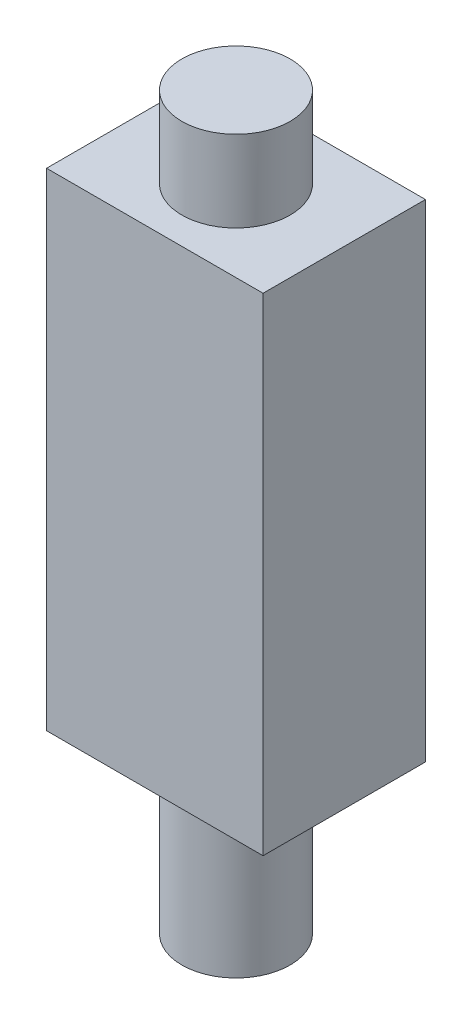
SolidWorks part; units mm, degrees
ref_plane "Front Plane" through (0, 0, 0) normal (0, 0, 1) x (1, 0, 0)
ref_plane "Top Plane" through (0, 0, 0) normal (0, 1, 0) x (1, 0, 0)
ref_plane "Right Plane" through (0, 0, 0) normal (1, 0, 0) x (0, 0, -1)
sketch "Sketch1" plane through (0, 0, 0) normal (0, 1, 0) x (1, 0, 0)
  circle A0 centre (0, 0) radius 1
  dimension "D1" = 2
extrude "Boss-Extrude1" add sketch "Sketch1" along normal blind 3
sketch "Sketch2" plane through (0, 3, 0) normal (0, 1, 0) x (1, 0, 0)
  line L1 (-2, -1.5) -> (2, -1.5)
  line L2 (-2, -1.5) -> (-2, 1.5)
  line L3 (-2, 1.5) -> (2, 1.5)
  line L4 (2, -1.5) -> (2, 1.5)
  line L5 (-2, -1.5) -> (2, 1.5) construction
  line L6 (-2, 1.5) -> (2, -1.5) construction
  point P0 (0, 0)
  dimension "D1" = 4
  dimension "D2" = 3
extrude "Boss-Extrude2" add sketch "Sketch2" along normal blind 9
sketch "Sketch3" plane through (0, 12, 0) normal (0, 1, 0) x (1, 0, 0)
  circle A0 centre (0, 0) radius 1
  dimension "D1" = 2
extrude "Boss-Extrude3" add sketch "Sketch3" along normal blind 1.5
sketch "Sketch4" plane through (0, 13.5, 0) normal (0, 1, 0) x (1, 0, 0)
  line L0 (0, 0) -> (0, 1) construction
  circle A0 centre (0, 0) radius 1 construction
